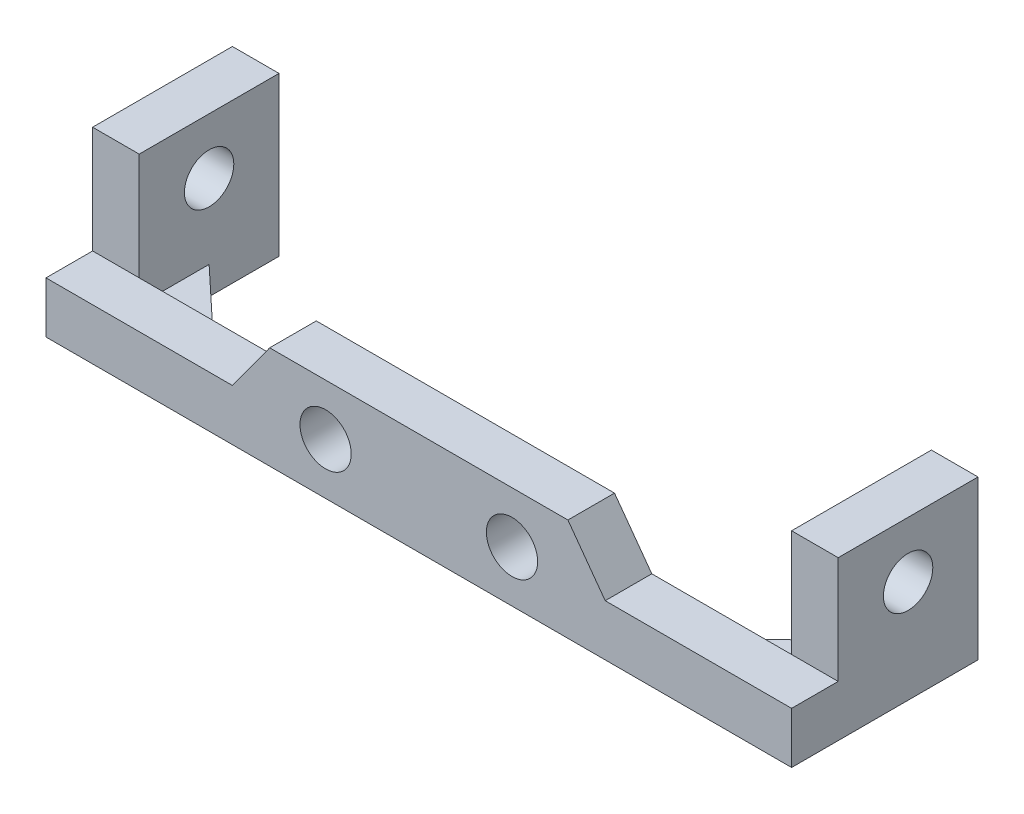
SolidWorks part; units mm, degrees
ref_plane "Plano frontal" through (0, 0, 0) normal (0, 0, 1) x (1, 0, 0)
ref_plane "Plano superior" through (0, 0, 0) normal (0, 1, 0) x (1, 0, 0)
ref_plane "Plano direito" through (0, 0, 0) normal (1, 0, 0) x (0, 0, -1)
sketch "Esboço1" plane through (0, 0, 0) normal (0, 1, 0) x (1, 0, 0)
  line L1 (0, 0) -> (80, 0)
  line L2 (0, 0) -> (0, 5)
  line L3 (0, 5) -> (80, 5)
  line L4 (80, 0) -> (80, 5)
  dimension "D1" = 80
  dimension "D2" = 5
extrude "Ressalto-extrusão1" add sketch "Esboço1" along normal blind 11
sketch "Esboço2" plane through (0, 0, 0) normal (0, 0, 1) x (1, 0, 0)
  line L0 (0, 5.5) -> (20, 5.5) construction
  line L1 (0, 11) -> (0, 0) construction
  line L2 (80, 11) -> (80, 0) construction
  line L3 (0, 11) -> (80, 11) construction
  line L4 (20, 5.5) -> (24, 11)
  line L5 (60, 5.5) -> (56, 11)
  line L6 (20, 5.5) -> (0, 5.5)
  line L7 (60, 5.5) -> (80, 5.5)
  line L10 (60, 5.5) -> (80, 5.5) construction
  circle A0 centre (30, 5.5) radius 2.75
  circle A1 centre (50, 5.5) radius 2.75
  point P6 (20, 5.5)
  point P7 (60, 5.5)
  point P8 (24, 11)
  point P9 (56, 11)
  point P12 (30, 5.5)
  point P15 (50, 5.5)
extrude "Corte-extrusão1" cut sketch "Esboço2" against normal through all contours L6 L4 M3 M4 | A0 | A1 | L5 L7 M2 M3
sketch "Esboço3" plane through (0, 0, 0) normal (0, -1, 0) x (1, 0, 0)
  line L0 (80, -5) -> (0, -5) construction
  line L2 (0, -5) -> (5, -5)
  line L3 (0, -5) -> (0, -20)
  line L4 (0, -20) -> (5, -20)
  line L5 (5, -5) -> (5, -20)
  line L6 (75, -5) -> (80, -5)
  line L7 (75, -5) -> (75, -20)
  line L8 (75, -20) -> (80, -20)
  line L9 (80, -5) -> (80, -20)
  point P0 (5, -5)
  point P1 (75, -5)
  dimension "D1" = 5
  dimension "D2" = 5
  dimension "D3" = 15
  dimension "D4" = 15
extrude "Ressalto-extrusão2" add sketch "Esboço3" against normal blind 17
sketch "Esboço4" plane through (0, 0, 0) normal (0, -1, 0) x (1, 0, 0)
  line L0 (75, -5) -> (5, -5) construction
  line L1 (5, -20) -> (5, -5) construction
  line L2 (75, -5) -> (75, -20) construction
  line L3 (5, -12.5) -> (13, -5)
  line L4 (13, -5) -> (5, -5)
  line L5 (5, -5) -> (5, -12.5)
  line L6 (67, -5) -> (75, -12.5)
  line L7 (75, -12.5) -> (75, -5)
  line L8 (75, -5) -> (67, -5)
  point P0 (13, -5)
  point P4 (67, -5)
  point P7 (75, -12.5)
  point P8 (5, -12.5)
  dimension "D1" = 7.5
  dimension "D2" = 7.5
  dimension "D3" = 8
  dimension "D4" = 8
extrude "Ressalto-extrusão3" add sketch "Esboço4" against normal blind 3
sketch "Esboço5" plane through (80, 0, 0) normal (1, 0, 0) x (0, 0, -1)
  circle A0 centre (12.5, 11) radius 2.65
  point P6 (12.5, 11)
  dimension "D2" = 5.3
extrude "Corte-extrusão2" cut sketch "Esboço5" against normal through all
